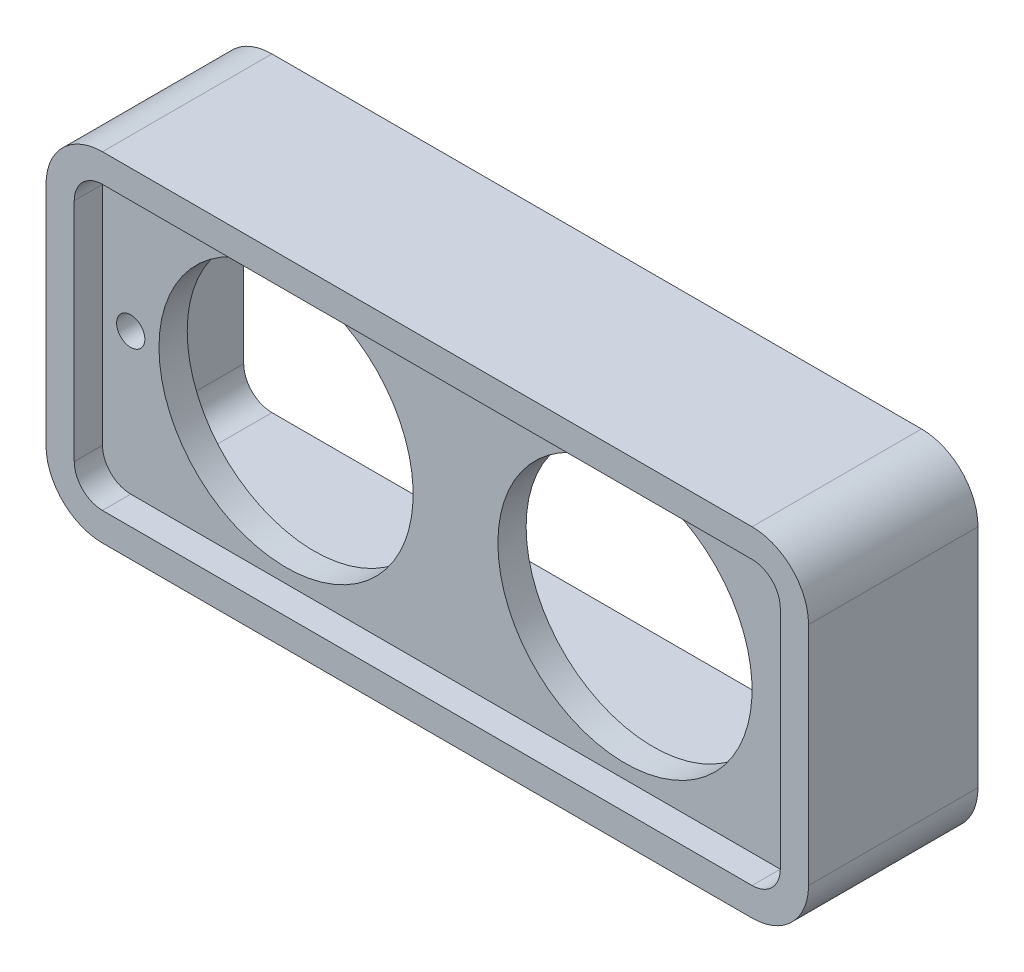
SolidWorks part; units mm, degrees
ref_plane "Plan de face" through (0, 0, 0) normal (0, 0, 1) x (1, 0, 0)
ref_plane "Plan de dessus" through (0, 0, 0) normal (0, 1, 0) x (1, 0, 0)
ref_plane "Plan de droite" through (0, 0, 0) normal (1, 0, 0) x (0, 0, -1)
sketch "Esquisse4" plane through (0, 0, 0) normal (0, 0, 1) x (1, 0, 0)
  line L1 (-11.5, -6) -> (11.5, -6)
  line L2 (-13.5, -4) -> (-13.5, 4)
  line L3 (-11.5, 6) -> (11.5, 6)
  line L4 (13.5, -4) -> (13.5, 4)
  line L5 (-13.5, -6) -> (13.5, 6) construction
  line L6 (-13.5, 6) -> (13.5, -6) construction
  arc A0 (-11.5, -6) -> (-13.5, -4) centre (-11.5, -4) cw
  arc A1 (11.5, -6) -> (13.5, -4) centre (11.5, -4) ccw
  arc A2 (11.5, 6) -> (13.5, 4) centre (11.5, 4) cw
  arc A3 (-13.5, 4) -> (-11.5, 6) centre (-11.5, 4) cw
  circle A4 centre (-11.5, 0) radius 0.5
  point P0 (0, 0)
  dimension "D3" = 2
  dimension "D4" = 0
  dimension "D5" = 11.5
  dimension "D1" = 12
  dimension "D2" = 27
extrude "Boss.-Extru.3" add sketch "Esquisse4" against normal blind 6
sketch "Esquisse8" plane through (0, 0, -6) normal (0, 0, -1) x (-1, 0, 0)
  line L1 (-11.5, -5) -> (11.5, -5)
  line L2 (-12.5, -4) -> (-12.5, 4)
  line L3 (-11.5, 5) -> (11.5, 5)
  line L4 (12.5, -4) -> (12.5, 4)
  line L5 (-12.5, -5) -> (12.5, 5) construction
  line L6 (-12.5, 5) -> (12.5, -5) construction
  arc A0 (11.5, 5) -> (12.5, 4) centre (11.5, 4) cw
  arc A1 (11.5, -5) -> (12.5, -4) centre (11.5, -4) ccw
  arc A2 (-11.5, -5) -> (-12.5, -4) centre (-11.5, -4) cw
  arc A3 (-12.5, 4) -> (-11.5, 5) centre (-11.5, 4) cw
  point P0 (0, 0)
  dimension "D3" = 1
  dimension "D1" = 10
  dimension "D2" = 25
extrude "Enlèv. mat.-Extru.4" cut sketch "Esquisse8" against normal blind 4
sketch "Esquisse9" plane through (0, 0, -2) normal (0, 0, -1) x (-1, 0, 0)
  circle A0 centre (6, 0) radius 4.5
  circle A1 centre (-6, 0) radius 4.5
  dimension "D1" = 6
  dimension "D3" = 9
  dimension "D4" = 9
  dimension "D2" = 6
extrude "Enlèv. mat.-Extru.5" cut sketch "Esquisse9" against normal through all
ref_point "Point1"
sketch "Esquisse10" plane through (0, 0, 0) normal (0, 0, 1) x (1, 0, 0)
  line L1 (-11.5, -5) -> (11.5, -5)
  line L2 (-12.5, -4) -> (-12.5, 4)
  line L3 (-11.5, 5) -> (11.5, 5)
  line L4 (12.5, -4) -> (12.5, 4)
  line L5 (-12.5, -5) -> (12.5, 5) construction
  line L6 (-12.5, 5) -> (12.5, -5) construction
  arc A0 (11.5, 5) -> (12.5, 4) centre (11.5, 4) cw
  arc A1 (11.5, -5) -> (12.5, -4) centre (11.5, -4) ccw
  arc A2 (-11.5, -5) -> (-12.5, -4) centre (-11.5, -4) cw
  arc A3 (-12.5, 4) -> (-11.5, 5) centre (-11.5, 4) cw
  point P0 (0, 0)
  dimension "D3" = 1
  dimension "D1" = 10
  dimension "D2" = 25
extrude "Enlèv. mat.-Extru.6" cut sketch "Esquisse10" against normal blind 1
